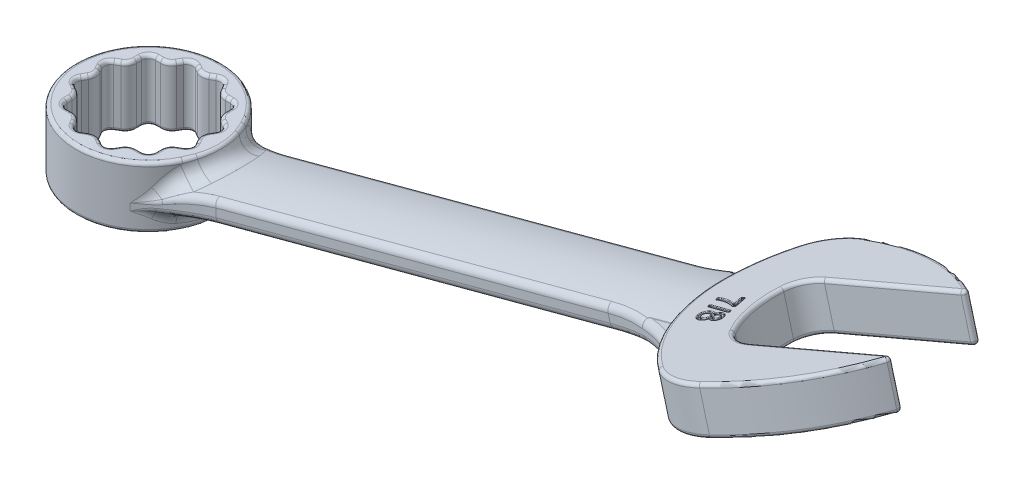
SolidWorks part; units mm, degrees
ref_plane "Front" through (0, 0, 0) normal (0, 0, 1) x (1, 0, 0)
ref_plane "Top" through (0, 0, 0) normal (0, 1, 0) x (1, 0, 0)
ref_plane "Right" through (0, 0, 0) normal (1, 0, 0) x (0, 0, -1)
sketch "Sketch2" plane through (0, 0, 0) normal (0, 1, 0) x (1, 0, 0)
  circle A0 centre (0, 0) radius 15.9639
  dimension "D1" = 31.9278
extrude "Extrude1" add sketch "Sketch2" along normal mid plane 13.462
sketch "Sketch4" plane through (0, 0, 0) normal (0, 1, 0) x (1, 0, 0)
  line L0 (15.9639, 26.689) -> (15.9639, -28.3264) construction
  circle A0 centre (0, 0) radius 15.9639 construction
ref_plane "Plane1" through (1.0694, -3.991, 0) normal (-0.2588, 0.9659, 0) x (-0.9659, -0.2588, 0)
ref_plane "Plane2" through (14.8945, 3.991, 0) normal (-0.9659, -0.2588, 0) x (0, 0, 1)
ref_plane "Plane3" through (131.4335, 35.2175, 0) normal (-0.9659, -0.2588, 0) x (0, 0, 1)
sketch "Sketch5" plane through (1.0694, -3.991, 0) normal (-0.2588, 0.9659, 0) x (-0.9659, -0.2588, 0)
  line L0 (-3.175, 0) -> (-136.0699, 0)
  line L2 (-136.0699, -28.8831) -> (-136.0699, 28.8831) construction
  dimension "D1" = 3.175
sketch "Sketch6" plane through (131.4335, 35.2175, 0) normal (-0.9659, -0.2588, 0) x (0, 0, 1)
  line L0 (8.6614, -2.0262) -> (8.6614, -6.2374)
  line L1 (-8.6614, -2.0262) -> (-8.6614, -6.2374)
  line L2 (-26.689, -4.1318) -> (28.3264, -4.1318) construction
  line L3 (-26.689, -4.1318) -> (28.3264, -4.1318) construction
  line L4 (0, 14.7287) -> (0, -18.3812) construction
  arc A0 (-8.6614, -2.0262) -> (8.6614, -2.0262) centre (0, -38.342) cw
  arc A1 (-8.6614, -6.2374) -> (8.6614, -6.2374) centre (0, 30.0785) ccw
  point P11 (0, 0)
  dimension "D2" = 6.2484
  dimension "D3" = 37.3344
  dimension "D1" = 17.3228
sweep "Sweep1" add profiles "Sketch6" path "Sketch5"
sketch "Sketch10" plane through (1.0694, -3.991, 0) normal (-0.2588, 0.9659, 0) x (-0.9659, -0.2588, 0)
  line L0 (-168.2417, -16.1049) -> (-143.9162, -9.587)
  line L1 (-13.3401, -8.6614) -> (-136.0699, -8.6614) construction
  line L2 (-13.3401, -8.6614) -> (-163.0659, -8.6614) construction
  line L3 (-174.0268, 5.4854) -> (-149.7013, 12.0034)
  line L4 (-156.0789, -12.8459) -> (-161.8641, 8.7444) construction
  line L5 (-158.9715, -2.0508) -> (-247.1572, -25.68) construction
  line L6 (-13.3401, 8.6614) -> (-136.0699, 8.6614) construction
  line L8 (-112.6915, 8.6614) -> (-115.697, -8.6614)
  arc A0 (-143.6543, 9.7396) -> (-139.8112, -4.6029) centre (-162.6169, -3.0275) cw
  arc A1 (-168.444, -17.4898) -> (-139.3227, -23.4123) centre (-145.8034, 19.2786) ccw
  arc A2 (-115.697, -8.6614) -> (-131.234, -17.7967) centre (-115.697, -26.4414) ccw
  arc A3 (-139.3227, -23.4123) -> (-131.234, -17.7967) centre (-141.0001, -12.3629) ccw
  arc A4 (-112.6915, 8.6614) -> (-139.4927, 22.3937) centre (-112.6915, 41.6814) cw
  arc A5 (-152.6359, 26.2733) -> (-139.4927, 22.3937) centre (-148.5639, 15.8655) cw
  arc A6 (-174.8945, 6.5836) -> (-152.6359, 26.2733) centre (-136.9029, -13.9385) cw
  arc A7 (-143.6543, 9.7396) -> (-149.7013, 12.0034) centre (-148.2633, 6.6365) ccw
  arc A8 (-143.9162, -9.587) -> (-139.8112, -4.6029) centre (-145.3543, -4.22) ccw
  arc A9 (-174.8945, 6.5836) -> (-174.0268, 5.4854) centre (-174.224, 6.2215) ccw
  arc A10 (-168.444, -17.4898) -> (-168.2417, -16.1049) centre (-168.0445, -16.841) cw
  point P31 (-140.462, -8.6614)
  point P34 (-175.6885, 5.0402)
  point P37 (-169.9034, -16.5502)
  dimension "D4" = 22.86
  dimension "D6" = 43.18
  dimension "D7" = 35.56
  dimension "D9" = 22.352
  dimension "D10" = 15.24
  dimension "D11" = 33.02
  dimension "D12" = 5.5562
  dimension "D13" = 0.762
  dimension "D1" = 15
  dimension "D2" = 140.462
  dimension "D5" = 30.48
  dimension "D8" = 115.697
  dimension "D3" = 22.352
extrude "Extrude2" add sketch "Sketch10" along normal up to vertex and the other way up to vertex
sketch "Sketch11" plane through (1.0694, -3.991, 0) normal (-0.2588, 0.9659, 0) x (-0.9659, -0.2588, 0)
  line L5 (-115.697, -8.6614) -> (-136.0699, -8.6614)
  line L6 (-136.0699, -8.6614) -> (-136.0699, 8.6614)
  line L7 (-136.0699, 8.6614) -> (-112.6915, 8.6614)
  line L8 (-174.0268, 5.4854) -> (-149.7013, 12.0034)
  line L9 (-143.9162, -9.587) -> (-168.2417, -16.1049)
  line L13 (-174.0268, 5.4854) -> (-149.7013, 12.0034)
  line L14 (-143.9162, -9.587) -> (-168.2417, -16.1049)
  arc A0 (-141.8711, 24.816) -> (-130.7288, -16.7678) centre (-162.7099, -3.0524) cw
  arc A11 (-139.4927, 22.3937) -> (-112.6915, 8.6614) centre (-112.6915, 41.6814) ccw
  arc A12 (-139.4927, 22.3937) -> (-152.6359, 26.2733) centre (-148.5639, 15.8655) ccw
  arc A13 (-152.6359, 26.2733) -> (-174.8945, 6.5836) centre (-136.9029, -13.9385) ccw
  arc A14 (-174.8945, 6.5836) -> (-174.0268, 5.4854) centre (-174.224, 6.2215) ccw
  arc A15 (-143.6543, 9.7396) -> (-149.7013, 12.0034) centre (-148.2633, 6.6365) ccw
  arc A16 (-139.8112, -4.6029) -> (-143.6543, 9.7396) centre (-162.6169, -3.0275) ccw
  arc A17 (-143.9162, -9.587) -> (-139.8112, -4.6029) centre (-145.3543, -4.22) ccw
  arc A18 (-168.2417, -16.1049) -> (-168.444, -17.4898) centre (-168.0445, -16.841) ccw
  arc A19 (-168.444, -17.4898) -> (-139.3227, -23.4123) centre (-145.8034, 19.2786) ccw
  arc A20 (-139.3227, -23.4123) -> (-131.234, -17.7967) centre (-141.0001, -12.3629) ccw
  arc A21 (-115.697, -8.6614) -> (-131.234, -17.7967) centre (-115.697, -26.4414) ccw
  arc A23 (-141.8711, 24.816) -> (-152.6359, 26.2733) centre (-148.5639, 15.8655) ccw
  arc A24 (-152.6359, 26.2733) -> (-174.8945, 6.5836) centre (-136.9029, -13.9385) ccw
  arc A25 (-174.8945, 6.5836) -> (-174.0268, 5.4854) centre (-174.224, 6.2215) ccw
  arc A26 (-143.6543, 9.7396) -> (-149.7013, 12.0034) centre (-148.2633, 6.6365) ccw
  arc A27 (-139.8112, -4.6029) -> (-143.6543, 9.7396) centre (-162.6169, -3.0275) ccw
  arc A28 (-143.9162, -9.587) -> (-139.8112, -4.6029) centre (-145.3543, -4.22) ccw
  arc A29 (-168.2417, -16.1049) -> (-168.444, -17.4898) centre (-168.0445, -16.841) ccw
  arc A30 (-168.444, -17.4898) -> (-139.3227, -23.4123) centre (-145.8034, 19.2786) ccw
  arc A31 (-139.3227, -23.4123) -> (-130.7288, -16.7678) centre (-141.0001, -12.3629) ccw
  dimension "D2" = 34.798
  dimension "D1" = 0
extrude "Extrude3" add sketch "Sketch11" along normal mid plane 9.652
fillet "Fillet1" radius 25.4
fillet "Fillet2" radius 1.524 4 edges at (14.8263, 1.4659, -10.177) (16.1276, -1.8505, -9.7455) (15.5689, -1.9505, 9.9212) (16.9538, 2.2244, 9.5112)
fillet "Fillet3" radius 3.175 6 edges at (15.8867, -3.221, -1.5685) (15.9589, 3.2309, 0.3979)
sketch "Sketch7" plane through (0, 6.731, 0) normal (0, 1, 0) x (-1, 0, 0)
  line L0 (21.389, 0) -> (-28.1554, 0) construction
  line L1 (8.2296, -9.7536) -> (7.0977, -9.7536)
  line L2 (9.7536, -8.2296) -> (9.7536, -7.0977)
  line L3 (8.2296, 9.7536) -> (7.0977, 9.7536)
  line L4 (-9.7536, -8.2296) -> (-9.7536, -7.0977)
  line L5 (0, -20.6792) -> (0, 21.738) construction
  line L6 (2.2502, -12.5617) -> (1.27, -11.9957)
  line L7 (-12.5617, -2.2502) -> (-11.9957, -1.27)
  line L8 (-2.2502, 12.5617) -> (-1.27, 11.9957)
  line L9 (12.5617, 2.2502) -> (11.9957, 1.27)
  line L10 (8.4469, -4.8768) -> (-8.4469, 4.8768) construction
  line L11 (-4.3321, -12.0038) -> (-4.898, -11.0236)
  line L12 (-12.0038, 4.3321) -> (-11.0236, 4.898)
  line L13 (4.3321, 12.0038) -> (4.898, 11.0236)
  line L14 (12.0038, -4.3321) -> (11.0236, -4.898)
  line L15 (4.8768, -8.4469) -> (-4.8768, 8.4469) construction
  line L16 (-11.9957, 1.27) -> (-12.5617, 2.2502)
  line L17 (-11.0236, -4.898) -> (-12.0038, -4.3321)
  line L18 (-9.7536, 7.0977) -> (-9.7536, 8.2296)
  line L19 (-4.898, 11.0236) -> (-4.3321, 12.0038)
  line L20 (1.27, 11.9957) -> (2.2502, 12.5617)
  line L21 (-7.0977, 9.7536) -> (-8.2296, 9.7536)
  line L22 (-7.0977, -9.7536) -> (-8.2296, -9.7536)
  line L23 (-1.27, -11.9957) -> (-2.2502, -12.5617)
  line L24 (4.898, -11.0236) -> (4.3321, -12.0038)
  line L25 (9.7536, 7.0977) -> (9.7536, 8.2296)
  line L26 (11.9957, -1.27) -> (12.5617, -2.2502)
  line L27 (11.0236, 4.898) -> (12.0038, 4.3321)
  arc A0 (4.3321, -12.0038) -> (2.2502, -12.5617) centre (3.0122, -11.2418) cw
  arc A1 (9.7536, -8.2296) -> (8.2296, -9.7536) centre (8.2296, -8.2296) cw
  arc A2 (12.5617, -2.2502) -> (12.0038, -4.3321) centre (11.2418, -3.0122) cw
  arc A3 (12.0038, 4.3321) -> (12.5617, 2.2502) centre (11.2418, 3.0122) cw
  arc A4 (8.2296, 9.7536) -> (9.7536, 8.2296) centre (8.2296, 8.2296) cw
  arc A5 (2.2502, 12.5617) -> (4.3321, 12.0038) centre (3.0122, 11.2418) cw
  arc A6 (-4.3321, 12.0038) -> (-2.2502, 12.5617) centre (-3.0122, 11.2418) cw
  arc A7 (-9.7536, 8.2296) -> (-8.2296, 9.7536) centre (-8.2296, 8.2296) cw
  arc A8 (-12.5617, 2.2502) -> (-12.0038, 4.3321) centre (-11.2418, 3.0122) cw
  arc A9 (-12.0038, -4.3321) -> (-12.5617, -2.2502) centre (-11.2418, -3.0122) cw
  arc A10 (-8.2296, -9.7536) -> (-9.7536, -8.2296) centre (-8.2296, -8.2296) cw
  arc A11 (-2.2502, -12.5617) -> (-4.3321, -12.0038) centre (-3.0122, -11.2418) cw
  arc A12 (-7.0977, -9.7536) -> (-4.898, -11.0236) centre (-7.0977, -12.2936) cw
  arc A13 (-11.0236, -4.898) -> (-9.7536, -7.0977) centre (-12.2936, -7.0977) cw
  arc A14 (-11.9957, 1.27) -> (-11.9957, -1.27) centre (-14.1954, 0) cw
  arc A15 (-9.7536, 7.0977) -> (-11.0236, 4.898) centre (-12.2936, 7.0977) cw
  arc A16 (-4.898, 11.0236) -> (-7.0977, 9.7536) centre (-7.0977, 12.2936) cw
  arc A17 (1.27, 11.9957) -> (-1.27, 11.9957) centre (0, 14.1954) cw
  arc A18 (7.0977, 9.7536) -> (4.898, 11.0236) centre (7.0977, 12.2936) cw
  arc A19 (11.0236, 4.898) -> (9.7536, 7.0977) centre (12.2936, 7.0977) cw
  arc A20 (11.9957, -1.27) -> (11.9957, 1.27) centre (14.1954, 0) cw
  arc A21 (9.7536, -7.0977) -> (11.0236, -4.898) centre (12.2936, -7.0977) cw
  arc A22 (4.898, -11.0236) -> (7.0977, -9.7536) centre (7.0977, -12.2936) cw
  arc A23 (-1.27, -11.9957) -> (1.27, -11.9957) centre (0, -14.1954) cw
  point P58 (-5.6312, -9.7536)
  point P63 (-11.2625, 0)
  point P70 (0, 11.2625)
  point P75 (9.7536, 5.6312)
  point P78 (11.2625, 0)
  point P83 (5.6312, -9.7536)
  point P86 (0, -11.2625)
  dimension "D7" = 1.524
  dimension "D8" = 2.54
  dimension "D1" = 19.5072
  dimension "D2" = 30
  dimension "D3" = 30
  dimension "D4" = 19.5072
  dimension "D5" = 19.5072
  dimension "D6" = 19.5072
extrude "Cut-Extrude1" cut sketch "Sketch7" against normal through all
fillet "Fillet7" radius 1.524
fillet "Fillet4" radius 0.762 15 edges at (122.978, 26.4945, 8.6614) (121.8881, 30.5622, 8.6614) (130.4359, 29.6934, 16.1302) (129.7835, 31.682, 15.9543) (123.5573, 33.641, 0.0905) (125.9644, 24.6632, 0.1066) (126.1431, 27.3425, 8.8631) (125.3082, 31.4786, 9.0908) (121.3112, 30.4076, -8.6614) (122.4856, 31.7762, 0.2192) (123.4111, 30.9703, -8.8009)
fillet "Fillet5" radius 0.762
sketch "Sketch12" plane through (-11.4964, -2.3617, 29.591) normal (-0.2588, 0.9659, 0) x (0.25, 0.067, 0.9659)
  text T0 "7/8" font "Arial" height 4.572
extrude "Cut-Extrude2" cut sketch "Sketch12" against normal blind 0.508
ref_plane "Plane4" through (112.8241, 25.9536, -8.6614) normal (0.2588, -0.9659, 0) x (0.9659, 0.2588, 0)
sketch "Sketch13" plane through (112.8241, 25.9536, -8.6614) normal (0.2588, -0.9659, 0) x (0.9659, 0.2588, 0)
  line L0 (-47.8745, 16.1025) -> (-47.8745, 1.2203) construction
  line L1 (-83.4345, 13.7414) -> (-12.3145, 13.7414)
  line L2 (-85.9745, 11.2014) -> (-85.9745, 6.1214)
  line L3 (-83.4345, 3.5814) -> (-12.3145, 3.5814)
  line L4 (-9.7745, 11.2014) -> (-9.7745, 6.1214)
  line L5 (-3.0055, 16.1025) -> (-92.7435, 16.1025) construction
  line L6 (-92.7435, 1.2203) -> (0, 1.2203) construction
  line L7 (-47.8745, 8.6614) -> (27.0589, 8.6614) construction
  line L8 (-85.9745, 13.7414) -> (-9.7745, 3.5814) construction
  line L9 (-83.4345, 12.2174) -> (-12.3145, 12.2174)
  line L10 (-11.2985, 11.2014) -> (-11.2985, 6.1214)
  line L11 (-83.4345, 5.1054) -> (-12.3145, 5.1054)
  line L12 (-84.4505, 11.2014) -> (-84.4505, 6.1214)
  arc A0 (-83.4345, 13.7414) -> (-85.9745, 11.2014) centre (-83.4345, 11.2014) ccw
  arc A1 (-85.9745, 6.1214) -> (-83.4345, 3.5814) centre (-83.4345, 6.1214) ccw
  arc A2 (-12.3145, 3.5814) -> (-9.7745, 6.1214) centre (-12.3145, 6.1214) ccw
  arc A3 (-12.3145, 13.7414) -> (-9.7745, 11.2014) centre (-12.3145, 11.2014) cw
  arc A4 (-12.3145, 12.2174) -> (-11.2985, 11.2014) centre (-12.3145, 11.2014) cw
  arc A5 (-12.3145, 5.1054) -> (-11.2985, 6.1214) centre (-12.3145, 6.1214) ccw
  arc A6 (-84.4505, 6.1214) -> (-83.4345, 5.1054) centre (-83.4345, 6.1214) ccw
  arc A7 (-83.4345, 12.2174) -> (-84.4505, 11.2014) centre (-83.4345, 11.2014) ccw
  point P18 (-85.9745, 3.5814)
  point P24 (-9.7745, 13.7414)
  dimension "D3" = 2.54
  dimension "D1" = 76.2
  dimension "D2" = 10.16
  dimension "D4" = 1.524
extrude "Extrude4" add sketch "Sketch13" along normal offset from surface (3.546 mm away) 0.762
sketch "Sketch14" plane through (112.8241, 25.9536, -8.6614) normal (0.2588, -0.9659, 0) x (0.9659, 0.2588, 0)
  text T0 "<b>BRAND NAME</b>" font "Verdana" height in points 18
extrude "Extrude5" add sketch "Sketch14" along normal offset from surface (3.8857 mm away) 0.762
fillet "Fillet8" radius 0.1524
fillet "Fillet9" radius 0.1524 20 edges at (131.5556, 35.9689, 0.8164) (132.1954, 36.1404, 2.156) (132.2955, 36.1672, 3.6453) (129.1966, 35.1528, 3.0282) (128.6555, 34.8237, 3.0564) (127.8694, 34.9812, 2.8802) (131.9143, 35.881, 3.157) (131.6863, 35.6358, 2.0982) (131.3349, 35.9098, 0.9238) (132.5089, 36.2244, 3.5399) (131.7985, 36.034, 0.7952) (127.851, 34.9763, 2.6218) (127.9685, 35.0078, 3.1077) (132.1201, 36.1202, 3.6843) (129.2675, 34.8891, 2.9948) (131.9838, 35.6666, 3.1713) (131.5943, 35.9793, 2.0982)
fillet "Fillet25" radius 0.1524
